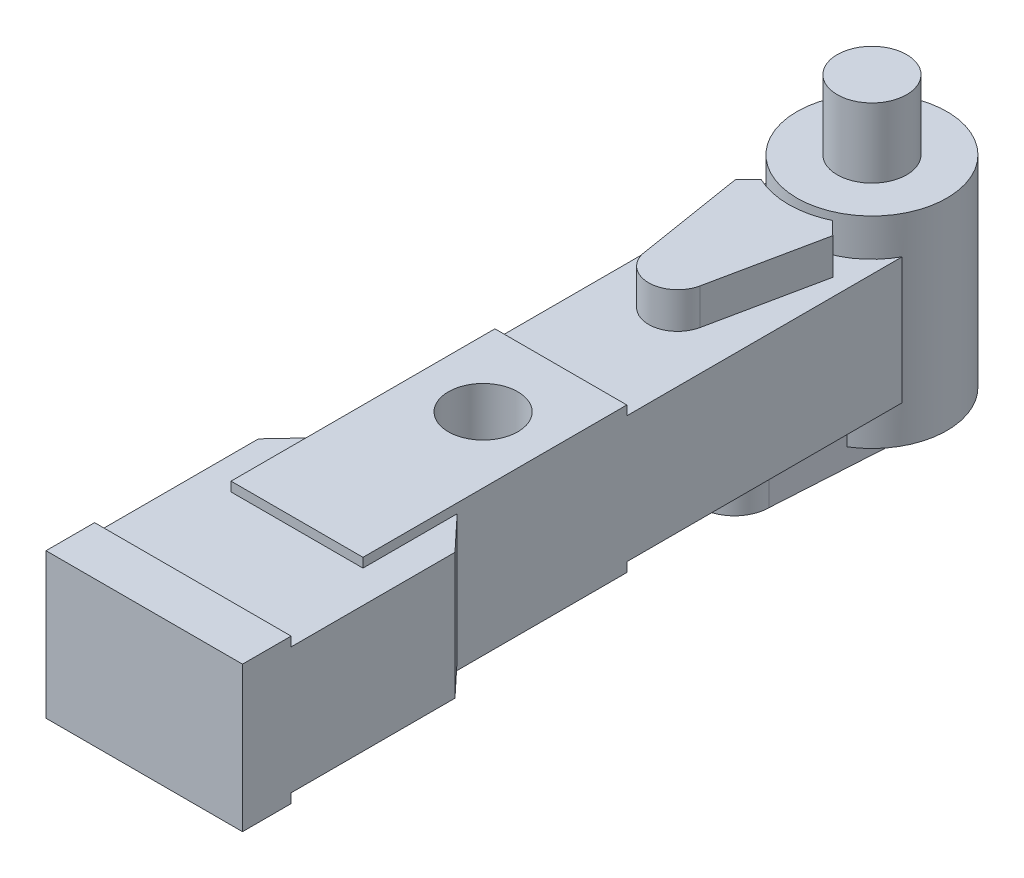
SolidWorks part; units mm, degrees
ref_plane "Front" through (0, 0, 0) normal (0, 0, 1) x (1, 0, 0)
ref_plane "Top" through (0, 0, 0) normal (0, 1, 0) x (1, 0, 0)
ref_plane "Right" through (0, 0, 0) normal (1, 0, 0) x (0, 0, -1)
sketch "Sketch1" plane through (0, 0, 0) normal (0, 1, 0) x (1, 0, 0)
  line L0 (-47.5, 177.808) -> (-70.75, 153)
  line L2 (-70.75, 153) -> (-70.75, 0)
  line L3 (-70.75, 0) -> (70.75, 0)
  line L4 (70.75, 153) -> (70.75, 0)
  line L6 (-47.5, 498.3144) -> (-47.5, 177.808)
  line L8 (47.5, 498.3144) -> (47.5, 177.808)
  line L9 (47.5, 177.808) -> (70.75, 153)
  arc A0 (47.5, 498.3144) -> (-47.5, 498.3144) centre (0, 524) ccw
  dimension "D1" = 108
  dimension "D2" = 524
  dimension "D3" = 153
  dimension "D4" = 34
  dimension "D6" = 141.5
extrude "Extrude1" add sketch "Sketch1" along normal mid plane 91
sketch "Sketch3" plane through (0, 0, 0) normal (0, 1, 0) x (1, 0, 0)
  line L1 (-70.75, 0) -> (70.75, 0)
  line L2 (-70.75, 0) -> (-70.75, 35)
  line L3 (-70.75, 35) -> (70.75, 35)
  line L4 (70.75, 0) -> (70.75, 35)
  line L5 (-47.5, 498.3144) -> (-47.5, 177.808) construction
  line L6 (-47.5, 110) -> (47.5, 110)
  line L7 (47.5, 110) -> (47.5, 300)
  line L8 (47.5, 177.808) -> (47.5, 498.3144) construction
  line L9 (47.5, 300) -> (-47.5, 300)
  line L11 (-47.5, 300) -> (-47.5, 110)
  dimension "D1" = 35
  dimension "D2" = 110
  dimension "D3" = 190
extrude "Extrude2" add sketch "Sketch3" along normal mid plane 104.5
sketch "Sketch4" plane through (0, 0, 0) normal (0, 1, 0) x (1, 0, 0)
  circle A0 centre (0, 524) radius 54
  arc A1 (47.5, 498.3144) -> (-47.5, 498.3144) centre (0, 524) ccw construction
  dimension "D1" = 108
extrude "Extrude3" add sketch "Sketch4" along normal mid plane 145
sketch "Sketch5" plane through (0, -45.5, 0) normal (0, -1, 0) x (1, 0, 0)
  line L0 (30.778, -520.2965) -> (25, -425)
  line L1 (-25, -425) -> (-30.778, -520.2965)
  arc A0 (-30.778, -520.2965) -> (30.778, -520.2965) centre (0, -524) ccw
  arc A1 (25, -425) -> (-25, -425) centre (0, -425) ccw
  circle A3 centre (0, -524) radius 54 construction
  dimension "D1" = 62
  dimension "D2" = 50
  dimension "D3" = 99
extrude "Extrude4" add sketch "Sketch5" along normal blind 40
sketch "Sketch6" plane through (0, 52.25, 0) normal (0, 1, 0) x (-1, 0, 0)
  circle A0 centre (0, -244) radius 25
  circle A1 centre (0, -524) radius 54 construction
  dimension "D2" = 50
  dimension "D1" = 280
extrude "Cut-Extrude1" cut sketch "Sketch6" against normal blind 50
sketch "Sketch7" plane through (0, 72.5, 0) normal (0, 1, 0) x (-1, 0, 0)
  circle A0 centre (0, -524) radius 25
  circle A1 centre (0, -524) radius 54 construction
  dimension "D1" = 50
extrude "Extrude5" add sketch "Sketch7" along normal blind 50
sketch "Sketch8" plane through (0, 45.5, 0) normal (0, 1, 0) x (-1, 0, 0)
  line L0 (-25.7022, -469.7838) -> (25.7022, -469.7838) construction
  line L1 (-35.2978, -364.7838) -> (34.7022, -364.7838) construction
  line L2 (-25.7022, -469.7838) -> (-35.2978, -460.4908)
  line L3 (25.7022, -469.7838) -> (34.7022, -460.4908)
  line L4 (-0.2978, -395.79) -> (-0.2978, -498.3309) construction
  line L5 (-38.1155, -460.4908) -> (34.7022, -460.4908) construction
  line L6 (34.7022, -460.4908) -> (21.8226, -380.5018)
  line L7 (-35.2978, -460.4908) -> (-18.8555, -381.4148)
  arc A0 (25.7022, -469.7838) -> (-25.7022, -469.7838) centre (0, -524) ccw
  arc A1 (-18.8555, -381.4148) -> (21.8226, -380.5018) centre (1.5892, -385.6658) cw
  dimension "D1" = 70
  dimension "D3" = 26
  dimension "D4" = 105
  dimension "D2" = 35
extrude "Extrude10" add sketch "Sketch8" along normal blind 26
